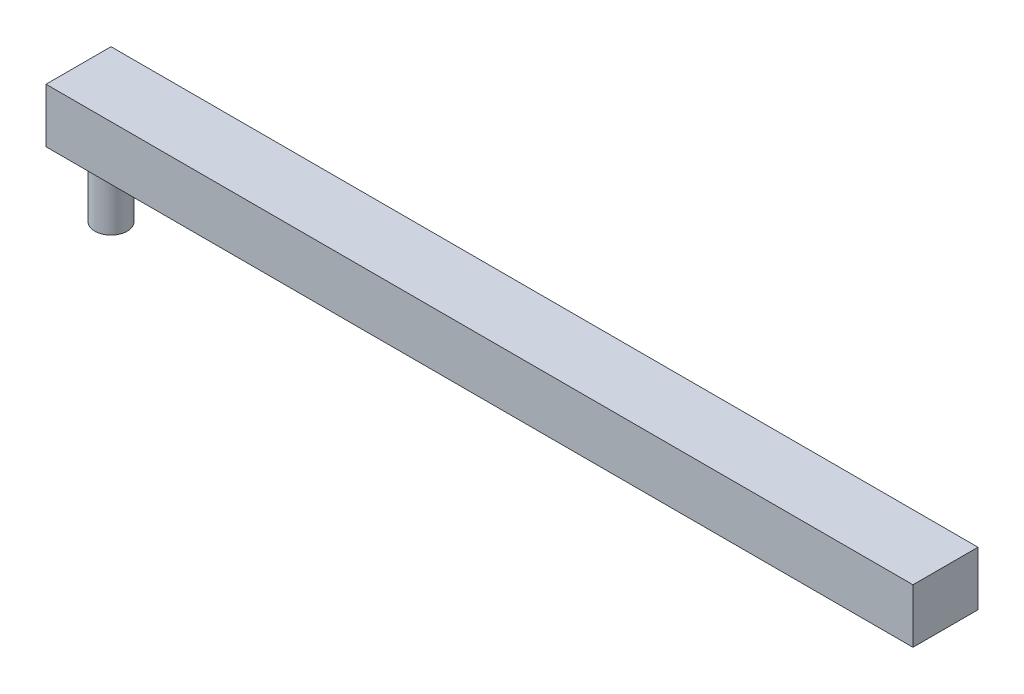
SolidWorks part; units mm, degrees
ref_plane "Front Plane" through (0, 0, 0) normal (0, 0, 1) x (1, 0, 0)
ref_plane "Top Plane" through (0, 0, 0) normal (0, 1, 0) x (1, 0, 0)
ref_plane "Right Plane" through (0, 0, 0) normal (1, 0, 0) x (0, 0, -1)
sketch "Sketch1" plane through (0, -6, 0) normal (0, 1, 0) x (1, 0, 0)
  line L0 (72.1794, 0) -> (-2.8206, 0)
  line L1 (2.1794, 0) -> (72.1794, 0) construction
  line L3 (-2.8206, 0) -> (-7.8206, 0)
  line L4 (-7.8206, 0) -> (-7.8206, 6)
  line L5 (-7.8206, 6) -> (72.1794, 6)
  line L7 (72.1794, 6) -> (72.1794, 0)
  point P5 (0, 0)
  point P13 (0, 0)
  point P14 (0, 0)
  point P15 (0, 0)
  point P16 (-6.7009, 0)
  point P17 (0, 0)
  point P18 (0, 0)
  point P19 (-3.1158, 0)
  dimension "D1" = 80
  dimension "D2" = 6
extrude "Boss-Extrude1" add sketch "Sketch1" along normal blind 5
sketch "Sketch2" plane through (0, -6, 0) normal (0, -1, 0) x (1, 0, 0)
  line L0 (-4.8206, -6) -> (-4.8206, 0) construction
  line L1 (72.1794, -6) -> (-7.8206, -6) construction
  line L2 (-7.8206, 0) -> (72.1794, 0) construction
  line L3 (-7.8206, -6) -> (-7.8206, 0) construction
  circle A0 centre (-4.8206, -3) radius 1.5
  point P3 (0, 0)
  point P4 (-4.8206, -3)
  dimension "D2" = 3
  dimension "D1" = 3
extrude "Boss-Extrude2" add sketch "Sketch2" along normal up to surface (6 mm away)
